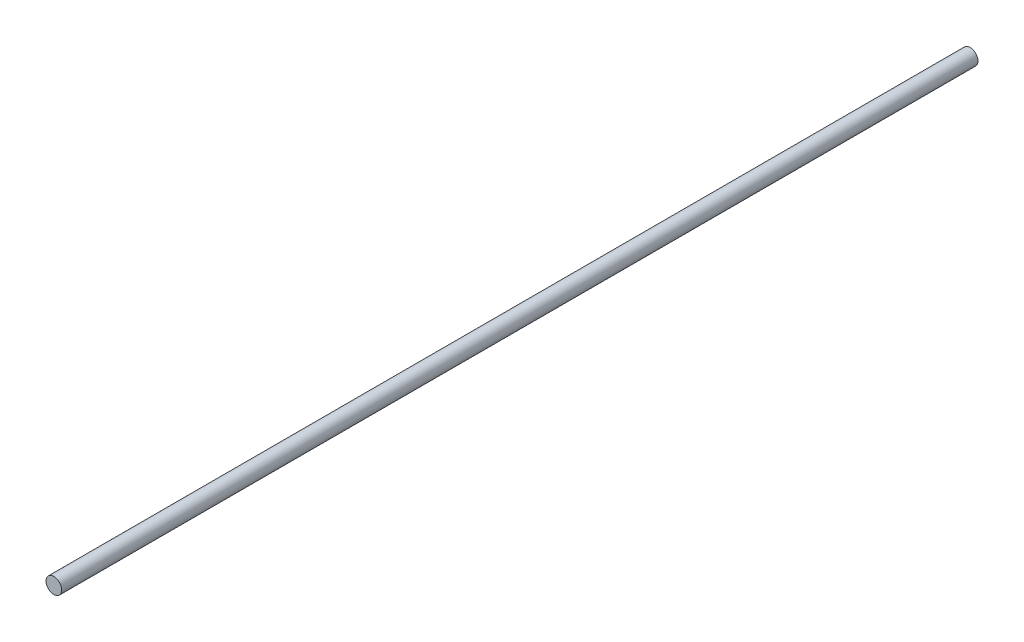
SolidWorks part; units mm, degrees
ref_plane "Front Plane" through (0, 0, 0) normal (0, 0, 1) x (1, 0, 0)
ref_plane "Top Plane" through (0, 0, 0) normal (0, 1, 0) x (1, 0, 0)
ref_plane "Right Plane" through (0, 0, 0) normal (1, 0, 0) x (0, 0, -1)
sketch "Sketch1" plane through (0, 0, 0) normal (0, 0, 1) x (1, 0, 0)
  circle A0 centre (0, 0) radius 30
  dimension "D1" = 60
extrude "Boss-Extrude1" add sketch "Sketch1" against normal blind 3500
